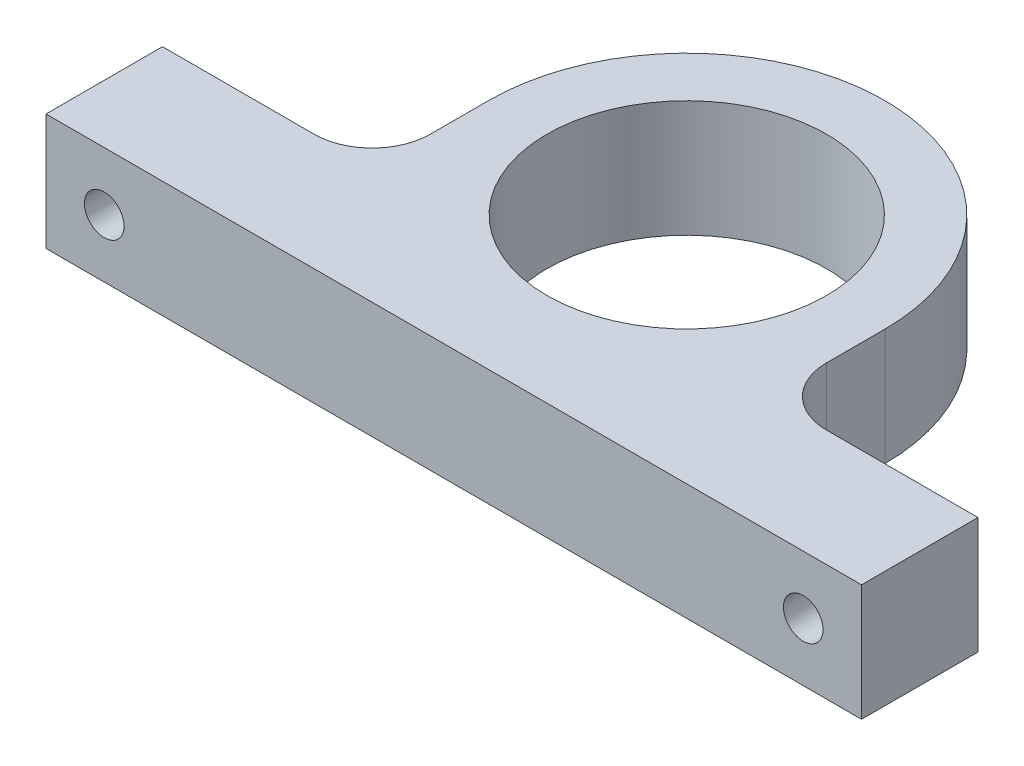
SolidWorks part; units mm, degrees
ref_plane "Front Plane" through (0, 0, 0) normal (0, 0, 1) x (1, 0, 0)
ref_plane "Top Plane" through (0, 0, 0) normal (0, 1, 0) x (1, 0, 0)
ref_plane "Right Plane" through (0, 0, 0) normal (1, 0, 0) x (0, 0, -1)
sketch "Sketch1" plane through (0, 0, 0) normal (0, 1, 0) x (1, 0, 0)
  line L0 (0, 0) -> (0, 20) construction
  line L5 (35, 0) -> (-35, 0)
  line L6 (-35, 0) -> (-35, 10)
  line L7 (-17, 10) -> (-35, 10)
  line L8 (-17, 20) -> (-17, 10)
  line L9 (0, 20) -> (0, 120.2965) construction
  line L10 (17, 20) -> (17, 10)
  line L11 (17, 10) -> (35, 10)
  line L12 (35, 0) -> (35, 10)
  circle A0 centre (0, 20) radius 12
  arc A1 (17, 20) -> (-17, 20) centre (0, 20) ccw
  dimension "D1" = 24
  dimension "D2" = 35
  dimension "D4" = 5
  dimension "D3" = 10
  dimension "D5" = 20
extrude "Boss-Extrude1" add sketch "Sketch1" along normal blind 10
fillet "Fillet1" radius 5 2 edges at (-17, 5, -10) (17, 5, -10)
sketch "Sketch2" plane through (0, 0, -10) normal (0, 0, -1) x (-1, 0, 0)
  line L0 (0, 0) -> (0, 10) construction
  line L1 (-17, 0) -> (17, 0) construction
  line L2 (17, 10) -> (-17, 10) construction
  line L3 (-35, 10) -> (-22, 10) construction
  line L4 (-35, 10) -> (-35, 0) construction
  point P0 (-30, 5)
  point P7 (0, 0)
  point P8 (30, 5)
  dimension "D1" = 5
  dimension "D2" = 5
hole_wizard "CSK for M3 Flat Head Machine Screw1" positions "3DSketch1" profile "Sketch3" countersink size "M3" standard "ANSI Metric"
sketch3d "3DSketch1"
  point P0 (30, 5, -10)
  point P3 (-30, 5, -10)
sketch "Sketch3" plane through (30, 5, -10) normal (1, 0, 0) x (0, 1, 0)
  line L0 (0, 0) -> (0, 10)
  line L1 (0, 10) -> (1.7, 10)
  line L2 (1.7, 10) -> (1.7, 1.45)
  line L3 (1.7, 1.45) -> (3.15, 0)
  line L5 (3.15, 0) -> (0, 0)
  line L6 (-1.7, 1.45) -> (-3.15, 0) construction
  line L11 (0, -6.35) -> (0, 107.95) construction
  dimension "Thru Hole Dia." = 3.4
  dimension "Thru Hole Depth" = 10
  dimension "Near C'Sink Dia." = 6.3
  dimension "Near C'Sink Angle" = 90
